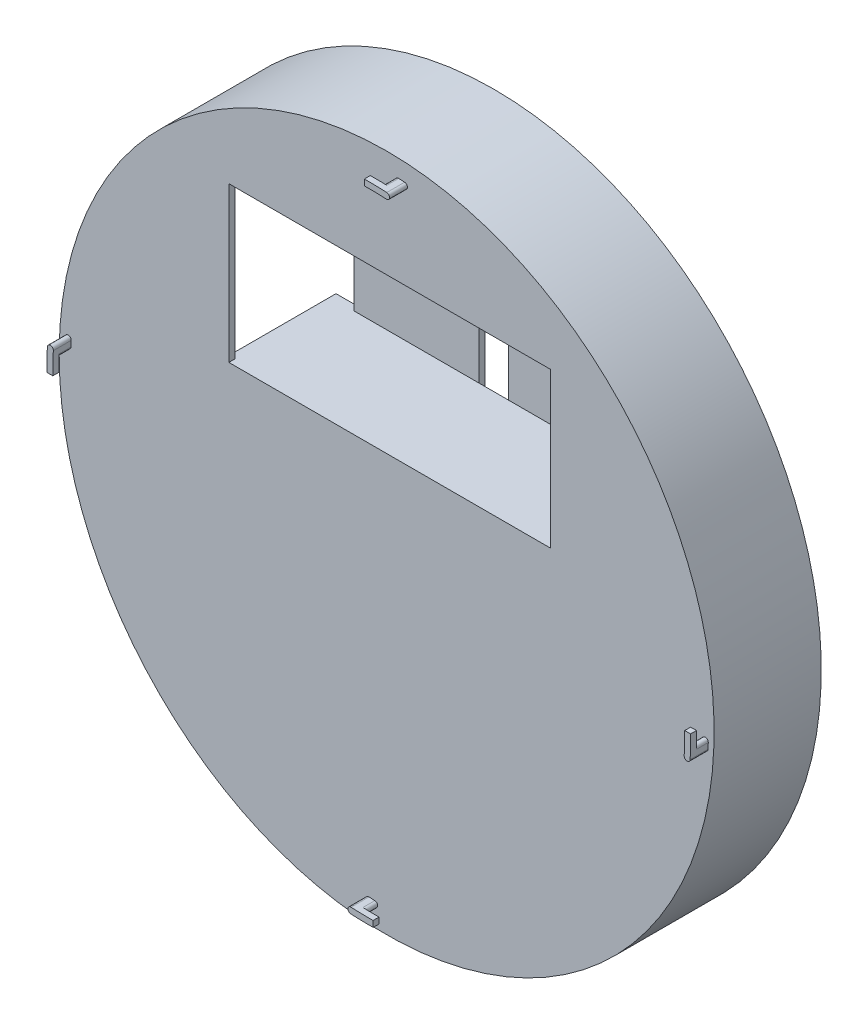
SolidWorks part; units mm, degrees
ref_plane "Plan de face" through (0, 0, 0) normal (0, 0, 1) x (1, 0, 0)
ref_plane "Plan de dessus" through (0, 0, 0) normal (0, 1, 0) x (1, 0, 0)
ref_plane "Plan de droite" through (0, 0, 0) normal (1, 0, 0) x (0, 0, -1)
sketch "Esquisse1" plane through (0, 0, 0) normal (0, 0, 1) x (1, 0, 0)
  ellipse E0 centre (0, 0) end of major axis (0, 57) minor radius 55
  dimension "D1" = 55
  dimension "D2" = 57
extrude "Boss.-Extru.1" add sketch "Esquisse1" along normal blind 18
sketch "Esquisse2" plane through (0, 0, 0) normal (0, 0, -1) x (-1, 0, 0)
  circle A0 centre (0, 0) radius 50
  dimension "D1" = 100
extrude "Enlèv. mat.-Extru.1" cut sketch "Esquisse2" against normal blind 17
sketch "Esquisse3" plane through (0, 0, 17) normal (0, 0, -1) x (-1, 0, 0)
  line L1 (-28.5, 40) -> (27.5, 40)
  line L2 (-28.5, 40) -> (-28.5, 12)
  line L3 (-28.5, 12) -> (27.5, 12)
  line L4 (27.5, 40) -> (27.5, 12)
  line L5 (-28.5, 40) -> (27.5, 12) construction
  line L6 (-28.5, 12) -> (27.5, 40) construction
  circle A0 centre (0, 0) radius 50 construction
  circle A1 centre (0, 0) radius 50 construction
  point P0 (-0.5, 26)
  dimension "D3" = 40
  dimension "D4" = 27.5
  dimension "D1" = 56
  dimension "D2" = 28
extrude "Boss.-Extru.2" add sketch "Esquisse3" along normal blind 18
sketch "Esquisse4" plane through (0, 0, 18) normal (0, 0, 1) x (1, 0, 0)
  line L0 (10.45, 0) -> (-10.45, 0) construction
  line L1 (-26.5, 39) -> (27.5, 39)
  line L2 (-26.5, 39) -> (-26.5, 13)
  line L3 (-26.5, 13) -> (27.5, 13)
  line L4 (27.5, 39) -> (27.5, 13)
  line L5 (-26.5, 39) -> (27.5, 13) construction
  line L6 (-26.5, 13) -> (27.5, 39) construction
  line L7 (0, -10.45) -> (0, 10.45) construction
  point P0 (0.5, 26)
  dimension "D1" = 54
  dimension "D2" = 26
  dimension "D3" = 39
  dimension "D4" = 27.5
extrude "Enlèv. mat.-Extru.2" cut sketch "Esquisse4" against normal blind 18
sketch "Esquisse5" plane through (0, 0, -1) normal (0, 0, -1) x (-1, 0, 0)
  line L0 (-2.5, 12) -> (2.5, 12)
  line L1 (-2.5, 12) -> (-2.5, 40)
  line L2 (2.5, 12) -> (2.5, 40)
  line L3 (-2.5, 40) -> (2.5, 40)
  line L4 (-28.5, 12) -> (27.5, 12) construction
  line L5 (-28.5, 12) -> (27.5, 12) construction
  line L7 (0, 10.45) -> (0, -10.45) construction
  dimension "D1" = 5
  dimension "D2" = 2.5
  dimension "D3" = 28
extrude "Enlèv. mat.-Extru.3" cut sketch "Esquisse5" against normal blind 1
sketch "Esquisse7" plane through (2.5, 0, 0) normal (-1, 0, 0) x (0, 0, 1)
  line L0 (-1, 40) -> (-1, 12)
  line L1 (-1, 12) -> (3, 40)
  line L2 (3, 40) -> (-1, 40)
  dimension "D1" = 4
extrude "Enlèv. mat.-Extru.4" cut sketch "Esquisse7" along normal blind 5
sketch "Esquisse8" plane through (0, 0, 17) normal (0, 0, -1) x (-1, 0, 0)
  line L0 (0, 40) -> (0, 50) construction
  line L1 (2.5, 40) -> (-2.5, 40) construction
  line L2 (-5.5, 46) -> (5.5, 46) construction
  line L3 (27.5, 40) -> (-28.5, 40) construction
  line L8 (-5.5, 46) -> (-5.5, 40)
  line L9 (-5.5, 46) -> (-2, 46)
  line L10 (-2, 46) -> (-2, 45)
  line L11 (-2, 45) -> (-4.5, 45)
  line L12 (-4.5, 45) -> (-4.5, 41)
  line L13 (-4.5, 41) -> (-2, 41)
  line L14 (-2, 41) -> (-2, 40)
  line L15 (-2, 40) -> (-5.5, 40)
  line L16 (5.5, 46) -> (5.5, 40)
  line L17 (2, 40) -> (5.5, 40)
  line L18 (2, 41) -> (2, 40)
  line L19 (4.5, 41) -> (2, 41)
  line L20 (4.5, 45) -> (4.5, 41)
  line L21 (2, 45) -> (4.5, 45)
  line L22 (2, 46) -> (2, 45)
  line L23 (5.5, 46) -> (2, 46)
  circle A0 centre (0, 0) radius 50 construction
  point P10 (0, 46)
  dimension "D1" = 11
  dimension "D2" = 6
  dimension "D3" = 6
  dimension "D4" = 3.5
  dimension "D5" = 3.5
  dimension "D6" = 1
  dimension "D7" = 4
  dimension "D8" = 1
extrude "Boss.-Extru.3" add sketch "Esquisse8" along normal blind 10
sketch "Esquisse9" plane through (0, 0, -1) normal (0, 0, -1) x (-1, 0, 0)
  line L0 (27.5, 12) -> (27.5, 40) construction
  line L7 (27.5, 13) -> (27.5, 39)
  line L8 (27.5, 13) -> (23.5, 13)
  line L9 (27.5, 39) -> (23.5, 39)
  line L10 (23.5, 13) -> (23.5, 39)
  point P0 (27.5, 26)
  dimension "D3" = 4
  dimension "D4" = 26
extrude "Enlèv. mat.-Extru.5" cut sketch "Esquisse9" against normal blind 18
sketch "Esquisse10" plane through (0, 0, -1) normal (0, 0, -1) x (-1, 0, 0)
  line L0 (-5.5, 40) -> (-28.5, 40) construction
  line L1 (-2.5, 40) -> (-2.5, 12) construction
  line L2 (27.5, 40) -> (2.5, 40) construction
  line L3 (2.5, 12) -> (2.5, 40) construction
  circle A0 centre (-9.5, 26) radius 3
  circle A1 centre (9.5, 26) radius 3
  dimension "D1" = 14
  dimension "D2" = 7
  dimension "D3" = 14
  dimension "D4" = 7
  dimension "D5" = 6
  dimension "D6" = 6
extrude "Boss.-Extru.4" add sketch "Esquisse10" along normal blind 15
sketch "Esquisse11" plane through (0, 0, 18) normal (0, 0, 1) x (1, 0, 0)
  arc A0 (-53.521, 2) -> (-53.4743, 3) centre (0, 0) cw construction
  arc A1 (-53.9735, 3.028) -> (-54.0207, 2.0187) centre (0, 0) ccw
  arc A2 (-52.9751, 2.972) -> (-53.0214, 1.9813) centre (0, 0) ccw
  arc A3 (-52.9751, 2.972) -> (-53.9735, 3.028) centre (-53.4743, 3) ccw
  arc A4 (-54.0207, 2.0187) -> (-53.0214, 1.9813) centre (-53.521, 2) ccw
  arc A5 (2, 53.521) -> (3, 53.4743) centre (0, 0) cw construction
  arc A6 (3.028, 53.9735) -> (2.0187, 54.0207) centre (0, 0) ccw
  arc A7 (2.972, 52.9751) -> (1.9813, 53.0214) centre (0, 0) ccw
  arc A8 (2.972, 52.9751) -> (3.028, 53.9735) centre (3, 53.4743) ccw
  arc A9 (2.0187, 54.0207) -> (1.9813, 53.0214) centre (2, 53.521) ccw
  arc A10 (53.521, -2) -> (53.4743, -3) centre (0, 0) cw construction
  arc A11 (53.9735, -3.028) -> (54.0207, -2.0187) centre (0, 0) ccw
  arc A12 (52.9751, -2.972) -> (53.0214, -1.9813) centre (0, 0) ccw
  arc A13 (52.9751, -2.972) -> (53.9735, -3.028) centre (53.4743, -3) ccw
  arc A14 (54.0207, -2.0187) -> (53.0214, -1.9813) centre (53.521, -2) ccw
  arc A15 (-2, -53.521) -> (-3, -53.4743) centre (0, 0) cw construction
  arc A16 (-3.028, -53.9735) -> (-2.0187, -54.0207) centre (0, 0) ccw
  arc A17 (-2.972, -52.9751) -> (-1.9813, -53.0214) centre (0, 0) ccw
  arc A18 (-2.972, -52.9751) -> (-3.028, -53.9735) centre (-3, -53.4743) ccw
  arc A19 (-2.0187, -54.0207) -> (-1.9813, -53.0214) centre (-2, -53.521) ccw
  point P4 (-53.5, 2.5001)
  point P14 (2.5001, 53.5)
  point P21 (53.5, -2.5001)
  point P28 (-2.5001, -53.5)
  point P33 (0, 0)
  dimension "D1" = 53.5
  dimension "D2" = 0.5
  dimension "D3" = 1
  dimension "D4" = 3
  dimension "D5" = 4
extrude "Boss.-Extru.5" add sketch "Esquisse11" along normal blind 3
ref_plane "Plan1" through (0, 0, 0) normal (0.056, 0.9984, 0) x (0.9984, -0.056, 0)
sketch "Esquisse12" plane through (0, 0, 0) normal (0.056, 0.9984, 0) x (0.9984, -0.056, 0)
  line L0 (-54.0584, -21) -> (-53.0584, -21)
  line L1 (-54.0584, -21) -> (-54.0584, -20)
  line L2 (-53.0584, -21) -> (-53.0584, -20)
  line L3 (-54.0584, -20) -> (-53.0584, -20)
  dimension "D1" = 1
revolve "Révolution1" add sketch "Esquisse12" angle 4 about axis through (0, 0, 17) along (0, 0, -1)
pattern_circular "Répétition circulaire1" count 4 every 90 about axis through (0, 0, 17) along (0, 0, -1) of "Révolution1"
